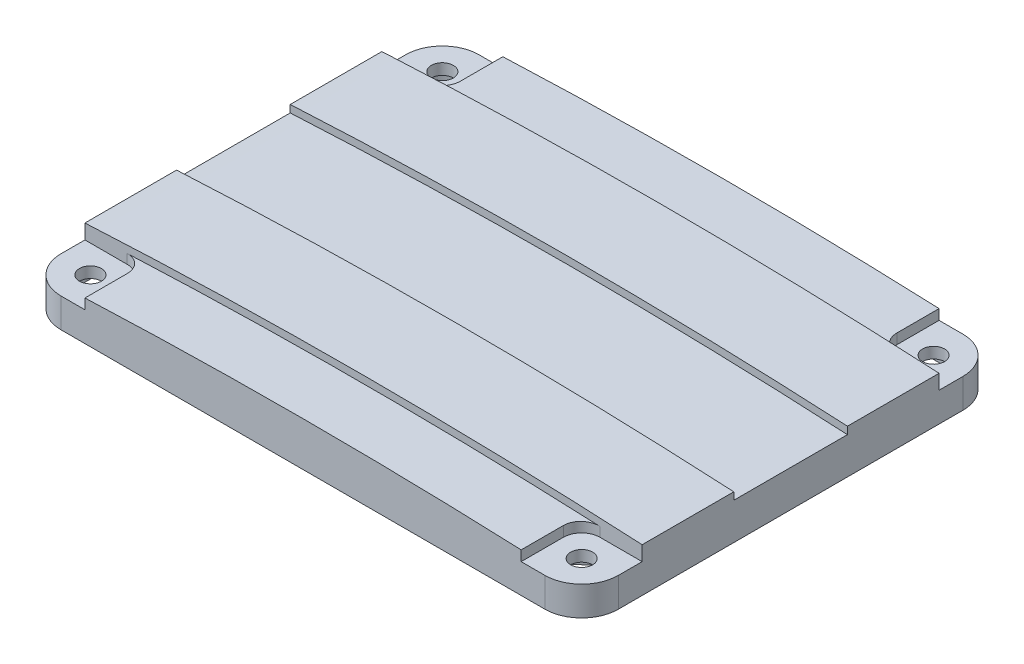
SolidWorks part; units mm, degrees
ref_plane "前视基准面" through (0, 0, 0) normal (0, 0, 1) x (1, 0, 0)
ref_plane "上视基准面" through (0, 0, 0) normal (0, 1, 0) x (1, 0, 0)
ref_plane "右视基准面" through (0, 0, 0) normal (1, 0, 0) x (0, 0, -1)
sketch "草图1" plane through (0, 0, 0) normal (0, 0, 1) x (1, 0, 0)
  line L0 (0, 4) -> (0, 4.028) construction
  line L3 (-76, 2) -> (-76, -0.0029)
  line L4 (76, 2) -> (76, -0.0029)
  line L5 (76, 2) -> (76, 0) construction
  line L6 (74, 0.1027) -> (74, 0) construction
  arc A0 (-76, 2) -> (76, 2) centre (0, -1421.0598) cw
  arc A1 (-76, -0.0029) -> (76, -0.0029) centre (0, -1421.0598) cw
  arc A2 (-75.8933, 0.0028) -> (74, 0.1027) centre (0, -1421.0598) cw construction
  dimension "D1" = 2
extrude "凸台-拉伸1" add sketch "草图1" along normal blind 114
sketch "草图2" plane through (0, 0, 114) normal (0, 0, 1) x (1, 0, 0)
  line L0 (-76, 2) -> (-76, 4.0028)
  line L1 (76, 2) -> (76, 4.0028)
  line L2 (76, -0.0029) -> (76, 2)
  line L3 (-76, 2) -> (-76, -0.0029)
  arc A0 (76, 4.0028) -> (-76, 4.0028) centre (0, -1421.0598) ccw
  arc A1 (76.1067, 3.9972) -> (-76.1067, 3.9972) centre (0, -1421.0598) ccw construction
  arc A2 (76, -0.0029) -> (-76, -0.0029) centre (0, -1421.0598) ccw
  arc A3 (76, 2) -> (-76, 2) centre (0, -1421.0598) ccw
  arc A5 (76, 2) -> (-76, 2) centre (0, -1421.0598) ccw
  dimension "D1" = 0
  dimension "D2" = 2
extrude "凸台-拉伸2" add sketch "草图2" against normal blind 25 from offset 16.5
sketch "草图3" plane through (0, 0, 97.5) normal (0, 0, 1) x (1, 0, 0)
  line L2 (76, 2) -> (76, 4.0028)
  line L3 (-76, 4.0028) -> (-76, 2)
  line L4 (76, 2) -> (76, 4.0028)
  line L5 (-76, 4.0028) -> (-76, 2)
  arc A2 (76, 2) -> (-76, 2) centre (0, -1421.0598) ccw
  arc A3 (76, 4.0028) -> (-76, 4.0028) centre (0, -1421.0598) ccw
  arc A4 (76, 2) -> (-76, 2) centre (0, -1421.0598) ccw
  arc A5 (76, 4.0028) -> (-76, 4.0028) centre (0, -1421.0598) ccw
  dimension "D1" = 0
extrude "凸台-拉伸3" add sketch "草图3" against normal blind 25 from offset 56
sketch "草图4" plane through (0, 0, 114) normal (0, 0, 1) x (1, 0, 0)
  line L2 (76, -0.0029) -> (76, 2)
  line L3 (-76, 2) -> (-76, -0.0029)
  line L4 (76, -0.0029) -> (76, 2)
  line L5 (-76, 2) -> (-76, -0.0029)
  arc A2 (76, -0.0029) -> (-76, -0.0029) centre (0, -1421.0598) ccw
  arc A3 (76, 2) -> (-76, 2) centre (0, -1421.0598) ccw
  arc A4 (76, -0.0029) -> (-76, -0.0029) centre (0, -1421.0598) ccw
  arc A5 (76, 2) -> (-76, 2) centre (0, -1421.0598) ccw
  dimension "D1" = 0
extrude "切除-拉伸1" cut sketch "草图4" against normal blind 17 from offset 20
sketch "草图5" plane through (0, 0, 114) normal (0, 0, 1) x (1, 0, 0)
  line L2 (76, -0.0029) -> (76, 2)
  line L3 (-76, 2) -> (-76, -0.0029)
  line L4 (76, -0.0029) -> (76, 2)
  line L5 (-76, 2) -> (-76, -0.0029)
  arc A2 (76, -0.0029) -> (-76, -0.0029) centre (0, -1421.0598) ccw
  arc A3 (76, 2) -> (-76, 2) centre (0, -1421.0598) ccw
  arc A4 (76, -0.0029) -> (-76, -0.0029) centre (0, -1421.0598) ccw
  arc A5 (76, 2) -> (-76, 2) centre (0, -1421.0598) ccw
  dimension "D1" = 0
extrude "切除-拉伸2" cut sketch "草图5" against normal blind 17 from offset 77
sketch "草图6" plane through (0, 0, 0) normal (0, 1, 0) x (1, 0, 0)
  line L0 (-76, -114) -> (76, -114)
  line L1 (76, -114) -> (76, 0)
  line L2 (76, 0) -> (-76, 0)
  line L3 (-76, -20) -> (-76, 0) construction
  line L4 (76, 0) -> (-76, 0) construction
  line L5 (-76, 0) -> (-76, -114)
  line L6 (-74, -2) -> (-74, -112)
  line L7 (-74, -112) -> (74, -112)
  line L8 (74, -112) -> (74, -2)
  line L9 (74, -2) -> (-74, -2)
  dimension "D1" = 2
extrude "凸台-拉伸4" add sketch "草图6" along normal up to body and the other way blind 8 separate body
sketch "草图7" plane through (0, -8, 0) normal (0, -1, 0) x (1, 0, 0)
  line L0 (73, 111) -> (-73, 111)
  line L1 (-73, 111) -> (-73, 3)
  line L2 (-73, 3) -> (73, 3)
  line L3 (73, 3) -> (73, 111)
  line L4 (68, 106) -> (-68, 106)
  line L5 (-68, 106) -> (-68, 8)
  line L6 (-68, 8) -> (68, 8)
  line L7 (68, 8) -> (68, 106)
  dimension "D1" = 5
extrude "凸台-拉伸5" add sketch "草图7" against normal up to body from offset 5 separate body
sketch "草图8" plane through (0, -3, 0) normal (0, -1, 0) x (1, 0, 0)
  line L0 (56, 106) -> (-56, 106)
  line L1 (-68, 95.7911) -> (-68, 18.2089)
  line L2 (-56, 8) -> (56, 8)
  line L3 (68, 18.2089) -> (68, 95.7911)
  line L4 (-66, 94.8667) -> (-66, 19.1333)
  line L5 (-55.2644, 10) -> (55.2644, 10)
  line L6 (66, 19.1333) -> (66, 94.8667)
  line L7 (55.2644, 104) -> (-55.2644, 104)
  line L12 (0, 8) -> (0, 106) construction
  line L13 (56, 106) -> (68, 95.7911)
  line L14 (-56, 106) -> (-68, 95.7911)
  line L15 (-55.2644, 104) -> (-66, 94.8667)
  line L16 (-54.704, 104.4767) -> (-66.704, 94.2678) construction
  line L17 (68, 106) -> (-68, 106) construction
  line L18 (66, 104) -> (-66, 104) construction
  line L19 (-66, 104) -> (-66, 10) construction
  line L20 (-68, 106) -> (-68, 8) construction
  line L21 (55.2644, 104) -> (66, 94.8667)
  line L22 (56, 8) -> (68, 18.2089)
  line L23 (68, 8) -> (68, 106) construction
  line L24 (66, 10) -> (66, 104) construction
  line L25 (0, 57) -> (68, 57) construction
  line L26 (55.2644, 10) -> (66, 19.1333)
  line L28 (-55.2644, 10) -> (-66, 19.1333)
  line L29 (-56, 8) -> (-68, 18.2089)
  line L30 (-68, 8) -> (68, 8) construction
  line L31 (-66, 10) -> (66, 10) construction
  dimension "D2" = 2
  dimension "D1" = 2
extrude "凸台-拉伸6" add sketch "草图8" against normal up to body from offset 3 separate body
sketch "草图9" plane through (0, -3, 0) normal (0, -1, 0) x (1, 0, 0)
  line L0 (0, 0) -> (0, 114) construction
  line L1 (-76, 114) -> (76, 114) construction
  line L2 (0, 57) -> (67, 57) construction
  line L3 (67, 57) -> (67, 105) construction
  line L6 (74.9373, 114) -> (59.0627, 114)
  line L13 (76, 112.9373) -> (76, 97.0627)
  line L15 (-76, 112.9373) -> (-76, 97.0627)
  line L16 (-74.9373, 114) -> (-59.0627, 114)
  line L17 (76, 1.0627) -> (76, 16.9373)
  line L18 (74.9373, 0) -> (59.0627, 0)
  line L19 (-76, 1.0627) -> (-76, 16.9373)
  line L20 (-74.9373, 0) -> (-59.0627, 0)
  arc A8 (59.0627, 114) -> (76, 97.0627) centre (67, 105) ccw
  arc A9 (76, 112.9373) -> (74.9373, 114) centre (67, 105) ccw
  arc A10 (-76, 112.9373) -> (-74.9373, 114) centre (-67, 105) cw
  arc A11 (-59.0627, 114) -> (-76, 97.0627) centre (-67, 105) cw
  arc A12 (76, 1.0627) -> (74.9373, 0) centre (67, 9) cw
  arc A13 (59.0627, 0) -> (76, 16.9373) centre (67, 9) cw
  arc A14 (-59.0627, 0) -> (-76, 16.9373) centre (-67, 9) ccw
  arc A15 (-76, 1.0627) -> (-74.9373, 0) centre (-67, 9) ccw
extrude "凸台-拉伸7" add sketch "草图9" against normal up to body separate body
sketch "草图10" plane through (0, 0, 114) normal (0, 0, 1) x (1, 0, 0)
  line L0 (-76, -8) -> (-76, 0) construction
  line L1 (-76, 2) -> (-76, -8) construction
  line L2 (-76, 0) -> (-59.5, 0)
  line L3 (-59.5, 0) -> (-59.5, 4.7871)
  line L4 (-59.5, 4.7871) -> (-76, 4.7871)
  line L5 (-76, 4.7871) -> (-76, 0)
  line L6 (76, -8) -> (76, 0) construction
  line L7 (76, -8) -> (76, 2) construction
  line L8 (76, 0) -> (59.5, 0)
  line L9 (59.5, 0) -> (59.5, 6.5684)
  line L10 (59.5, 6.5684) -> (76, 6.5684)
  line L11 (76, 6.5684) -> (76, 0)
  arc A0 (76, 4.0028) -> (-76, 4.0028) centre (0, -1421.0598) ccw construction
extrude "切除-拉伸3" cut sketch "草图10" against normal up to surface (16.5 mm away)
sketch "草图11" plane through (0, 0, 0) normal (0, 0, -1) x (-1, 0, 0)
  line L0 (-76, -8) -> (-76, 0) construction
  line L1 (-76, 0) -> (-59.5, 0)
  line L2 (-59.5, 0) -> (-59.5, 7.9879)
  line L3 (-59.5, 7.9879) -> (-76, 7.9879)
  line L4 (-76, 7.9879) -> (-76, 0)
  line L5 (76, -8) -> (76, 0) construction
  line L6 (76, 2) -> (76, -8) construction
  line L7 (76, 0) -> (59.5, 0)
  line L8 (59.5, 0) -> (59.5, 9.099)
  line L9 (59.5, 9.099) -> (76, 9.099)
  line L10 (76, 9.099) -> (76, 0)
extrude "切除-拉伸4" cut sketch "草图11" against normal up to surface (16.5 mm away)
fillet "圆角1" radius 5 2 edges at (-59.5, 1.3927, 16.5) (59.5, 1.3927, 16.5)
fillet "圆角2" radius 5 2 edges at (-59.5, 1.3927, 97.5) (59.5, 1.3927, 97.5)
fillet "圆角3" radius 7 4 edges at (-74, -5.5, 2) (-74, -5.5, 112) (74, -5.5, 2) (74, -5.5, 112)
fillet "圆角4" radius 10 4 edges at (76, -4, 114) (76, -4, 0) (-76, -4, 0) (-76, -4, 114)
sketch "草图12" plane through (0, -3, 0) normal (0, -1, 0) x (1, 0, 0)
  line L0 (0, 0) -> (0, 114) construction
  line L1 (-66, 114) -> (66, 114) construction
  line L2 (0, 57) -> (67, 57) construction
  line L3 (67, 57) -> (67, 105) construction
  circle A0 centre (67, 105) radius 3
  circle A1 centre (-67, 105) radius 3
  circle A2 centre (67, 9) radius 3
  circle A3 centre (-67, 9) radius 3
extrude "切除-拉伸5" cut sketch "草图12" against normal blind 17
sketch "草图13" plane through (0, -3, 0) normal (0, -1, 0) x (1, 0, 0)
  line L0 (57.2532, 112) -> (-57.2532, 112)
  line L1 (-74, 95.2532) -> (-74, 18.7468)
  line L2 (-57.2532, 2) -> (57.2532, 2)
  line L3 (74, 18.7468) -> (74, 95.2532)
  line L12 (-74, 18.7468) -> (-74, 9)
  line L13 (-67, 2) -> (-57.2532, 2)
  line L14 (-56.6077, 3) -> (56.6077, 3)
  line L15 (57.2532, 2) -> (67, 2)
  line L16 (74, 9) -> (74, 18.7468)
  line L17 (73, 19.3923) -> (73, 94.6077)
  line L18 (74, 95.2532) -> (74, 105)
  line L19 (67, 112) -> (57.2532, 112)
  line L20 (56.6077, 111) -> (-56.6077, 111)
  line L21 (-57.2532, 112) -> (-67, 112)
  line L22 (-74, 105) -> (-74, 95.2532)
  line L23 (-73, 94.6077) -> (-73, 19.3923)
  line L26 (-56.6077, 3) -> (56.6077, 3)
  line L29 (73, 19.3923) -> (73, 94.6077)
  line L32 (56.6077, 111) -> (-56.6077, 111)
  line L35 (-73, 94.6077) -> (-73, 19.3923)
  arc A12 (-74, 9) -> (-67, 2) centre (-67, 9) ccw
  arc A13 (-57.2532, 2) -> (-56.6077, 3) centre (-67, 9) ccw
  arc A14 (56.6077, 3) -> (57.2532, 2) centre (67, 9) ccw
  arc A15 (67, 2) -> (74, 9) centre (67, 9) ccw
  arc A16 (74, 18.7468) -> (73, 19.3923) centre (67, 9) ccw
  arc A17 (73, 94.6077) -> (74, 95.2532) centre (67, 105) ccw
  arc A18 (74, 105) -> (67, 112) centre (67, 105) ccw
  arc A19 (57.2532, 112) -> (56.6077, 111) centre (67, 105) ccw
  arc A20 (-56.6077, 111) -> (-57.2532, 112) centre (-67, 105) ccw
  arc A21 (-67, 112) -> (-74, 105) centre (-67, 105) ccw
  arc A22 (-74, 95.2532) -> (-73, 94.6077) centre (-67, 105) ccw
  arc A23 (-73, 19.3923) -> (-74, 18.7468) centre (-67, 9) ccw
  arc A25 (-57.2532, 2) -> (-56.6077, 3) centre (-67, 9) ccw
  arc A26 (56.6077, 3) -> (57.2532, 2) centre (67, 9) ccw
  arc A28 (74, 18.7468) -> (73, 19.3923) centre (67, 9) ccw
  arc A29 (73, 94.6077) -> (74, 95.2532) centre (67, 105) ccw
  arc A31 (57.2532, 112) -> (56.6077, 111) centre (67, 105) ccw
  arc A32 (-56.6077, 111) -> (-57.2532, 112) centre (-67, 105) ccw
  arc A34 (-74, 95.2532) -> (-73, 94.6077) centre (-67, 105) ccw
  arc A35 (-73, 19.3923) -> (-74, 18.7468) centre (-67, 9) ccw
  dimension "D1" = 0
extrude "凸台-拉伸8" add sketch "草图13" against normal up to body separate body
